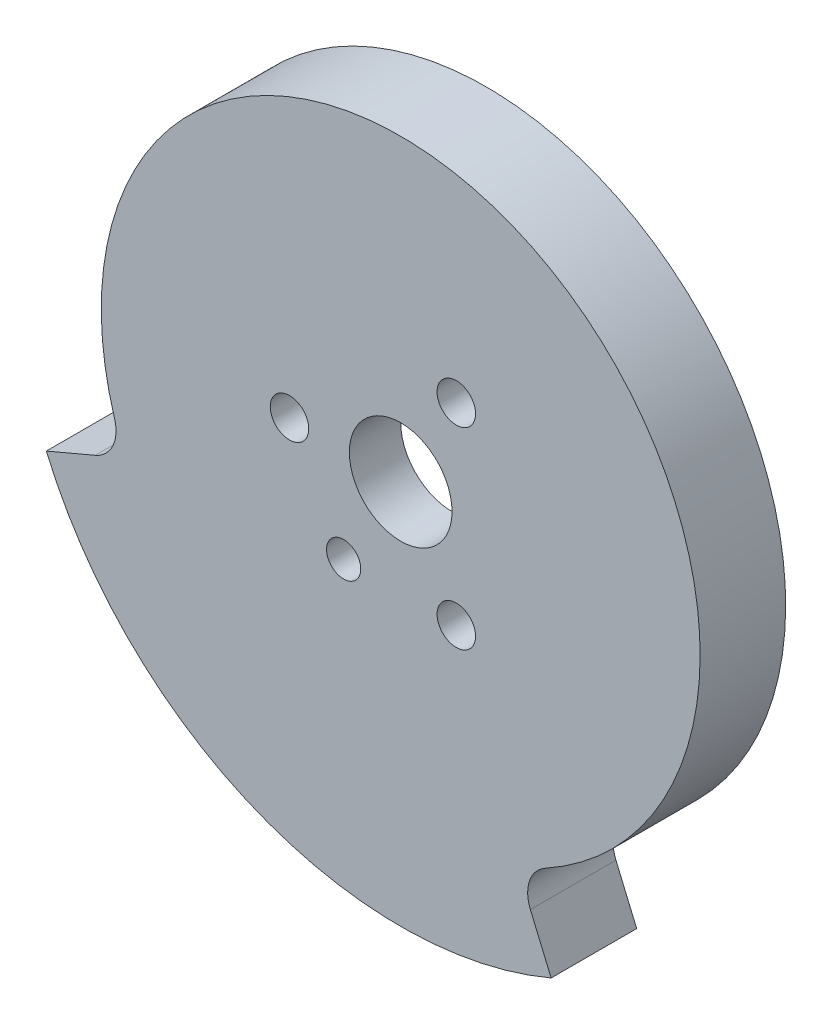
SolidWorks part; units mm, degrees
ref_plane "Face" through (0, 0, 0) normal (0, 0, 1) x (1, 0, 0)
ref_plane "Dessus" through (0, 0, 0) normal (0, 1, 0) x (1, 0, 0)
ref_plane "Droite" through (0, 0, 0) normal (1, 0, 0) x (0, 0, -1)
sketch "Esquisse1" plane through (0, 0, 0) normal (0, 0, 1) x (1, 0, 0)
  line L0 (-58.3182, 0) -> (52.45, 0) construction
  line L1 (15.1582, -35.7104) -> (17.5829, -41.4227)
  line L2 (-35.7104, -15.1582) -> (-41.4227, -17.5829)
  line L3 (0, 45.3855) -> (0, -61.0989) construction
  line L4 (0, 0) -> (6.5, 11.2583) construction
  line L5 (0, 0) -> (6.5, -11.2583) construction
  line L6 (0, 0) -> (-32.6984, -56.6352) construction
  arc A0 (-41.4227, -17.5829) -> (17.5829, -41.4227) centre (0, 0) ccw
  arc A1 (16.9078, -30.6451) -> (-33.4504, -10.2991) centre (0, 0) ccw
  arc A2 (-33.4504, -10.2991) -> (-35.7104, -15.1582) centre (-37.2733, -11.4761) cw
  arc A3 (16.9078, -30.6451) -> (15.1582, -35.7104) centre (18.8402, -34.1474) ccw
  circle A5 centre (-13, 0) radius 2.25
  circle A6 centre (6.5, 11.2583) radius 2.25
  circle A7 centre (6.5, -11.2583) radius 2.25
  circle A8 centre (0, 0) radius 6
  circle A9 centre (-6.6701, -11.1584) radius 2
  dimension "D1" = 4
  dimension "D2" = 90
  dimension "D3" = 70
  dimension "D4" = 4.5
  dimension "D5" = 4.5
  dimension "D8" = 12
  dimension "D10" = 4
  dimension "D11" = 4.5
  dimension "D6" = 120
  dimension "D7" = 120
  dimension "D9" = 120
extrude "Extrusion1" add sketch "Esquisse1" along normal blind 10
sketch "Esquisse2" plane through (0, 0, 0) normal (0, 0, -1) x (-1, 0, 0)
  circle A0 centre (0, 0) radius 25
extrude "Enlèv. mat.-Extru.1" cut sketch "Esquisse2" against normal blind 4
